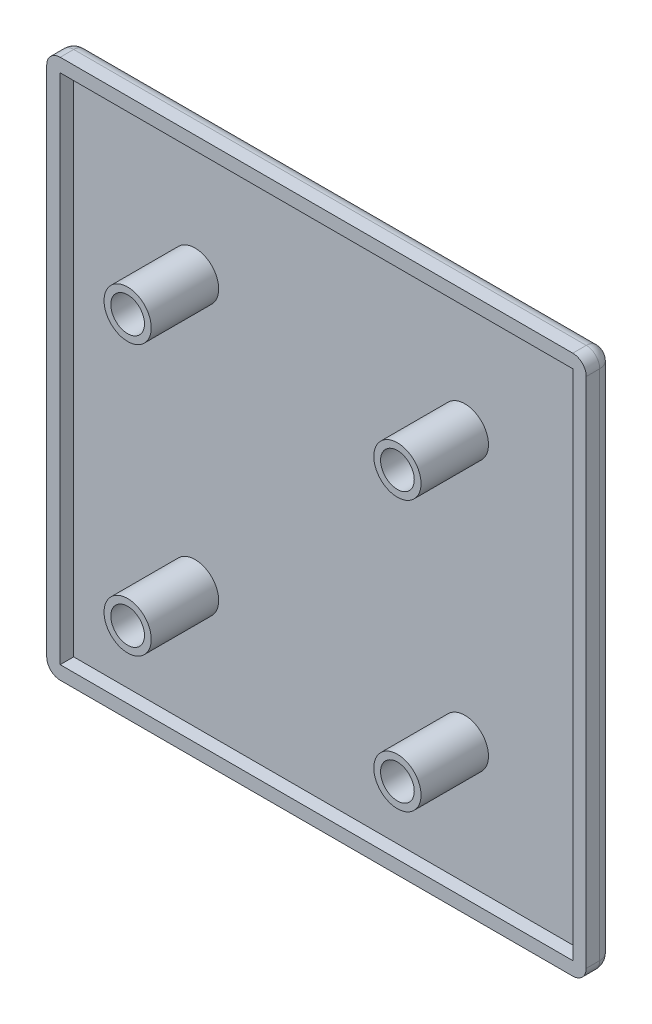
SolidWorks part; units mm, degrees
ref_plane "前视基准面" through (0, 0, 0) normal (0, 0, 1) x (1, 0, 0)
ref_plane "上视基准面" through (0, 0, 0) normal (0, 1, 0) x (1, 0, 0)
ref_plane "右视基准面" through (0, 0, 0) normal (1, 0, 0) x (0, 0, -1)
sketch "草图1" plane through (0, 0, 0) normal (0, 0, 1) x (1, 0, 0)
  line L1 (-40, 40) -> (40, 40)
  line L2 (-40, 40) -> (-40, -40)
  line L3 (-40, -40) -> (40, -40)
  line L4 (40, 40) -> (40, -40)
  dimension "D1" = 80
  dimension "D2" = 80
  dimension "D3" = 40
extrude "凸台-拉伸1" add sketch "草图1" along normal mid plane 4
shell "抽壳2" thickness 2
sketch "草图2" plane through (0, 0, 0) normal (0, 0, 1) x (1, 0, 0)
  line L0 (40, 40) -> (-40, 40) construction
  line L1 (-40, 40) -> (-40, -40) construction
  circle A0 centre (-20, 20) radius 3.5
  circle A1 centre (-20, -20) radius 3.5
  circle A2 centre (20, 20) radius 3.5
  circle A3 centre (20, -20) radius 3.5
  circle A4 centre (-20, 20) radius 2.5
  circle A5 centre (20, 20) radius 2.5
  circle A6 centre (20, -20) radius 2.5
  circle A7 centre (-20, -20) radius 2.5
  dimension "D1" = 7
  dimension "D2" = 20
  dimension "D3" = 20
  dimension "D4" = 7
  dimension "D5" = 7
  dimension "D6" = 40
  dimension "D7" = 40
extrude "凸台-拉伸2" add sketch "草图2" along normal blind 10
fillet "圆角1" radius 2 8 edges at (-40, 40, 0) (-40, 0, -2) (-40, -40, 0) (0, -40, -2) (40, -40, 0) (40, 0, -2) (0, 40, -2) (40, 40, 0)
